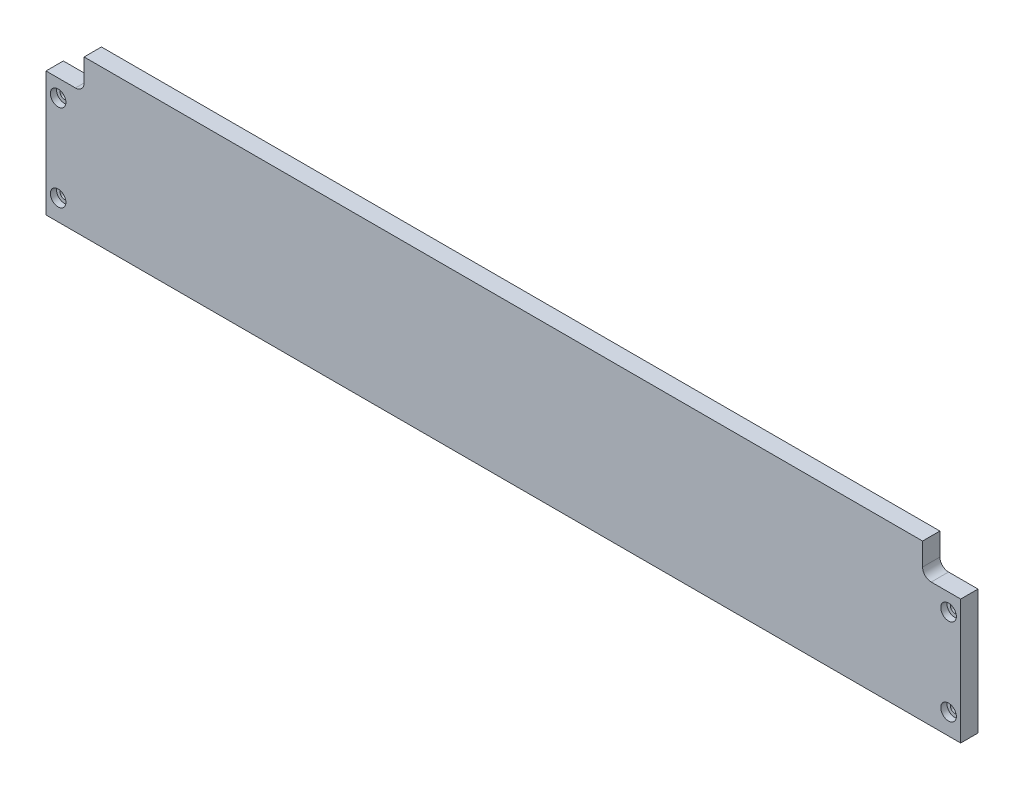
SolidWorks part; units mm, degrees
ref_plane "Front Plane" through (0, 0, 0) normal (0, 0, 1) x (1, 0, 0)
ref_plane "Top Plane" through (0, 0, 0) normal (0, 1, 0) x (1, 0, 0)
ref_plane "Right Plane" through (0, 0, 0) normal (1, 0, 0) x (0, 0, -1)
sketch "Sketch1" plane through (0, 0, 0) normal (0, 0, 1) x (1, 0, 0)
  line L0 (-1000, 0) -> (49000, 0) construction
  line L1 (0, -1000) -> (0, 49000) construction
  line L2 (335.28, 0) -> (-335.28, 0)
  line L3 (-335.28, 0) -> (-335.28, 91.44)
  line L4 (-335.28, 91.44) -> (-313.69, 91.44)
  line L5 (-307.34, 97.79) -> (-307.34, 114.3)
  line L6 (-307.34, 114.3) -> (307.34, 114.3)
  line L7 (307.34, 97.79) -> (307.34, 114.3)
  line L8 (335.28, 91.44) -> (313.69, 91.44)
  line L9 (335.28, 0) -> (335.28, 91.44)
  arc A0 (-313.69, 91.44) -> (-307.34, 97.79) centre (-313.69, 97.79) ccw
  arc A1 (313.69, 91.44) -> (307.34, 97.79) centre (313.69, 97.79) cw
  point P13 (-335.28, 45.72)
  point P18 (0, 114.3)
  point P20 (0, 0)
  dimension "D1" = 6.35
  dimension "D2" = 27.94
  dimension "D3" = 114.3
  dimension "D4" = 22.86
  dimension "D5" = 670.56
extrude "Boss-Extrude1" add sketch "Sketch1" along normal mid plane 12.7
sketch "Sketch2" plane through (0, 0, 6.35) normal (0, 0, 1) x (1, 0, 0)
  line L2 (335.28, 91.44) -> (313.69, 91.44) construction
  line L4 (335.28, 0) -> (335.28, 91.44) construction
  circle A0 centre (326.39, 78.74) radius 5.715
  dimension "D3" = 11.43
  dimension "D1" = 8.89
  dimension "D2" = 12.7
extrude "Cut-Extrude1" cut sketch "Sketch2" against normal blind 4.572
sketch "Sketch3" plane through (0, 0, 1.778) normal (0, 0, 1) x (1, 0, 0)
  circle A0 centre (326.39, 78.74) radius 3.175
  circle A1 centre (326.39, 78.74) radius 5.715 construction
  dimension "D1" = 6.35
extrude "Cut-Extrude2" cut sketch "Sketch3" against normal blind 11.43
pattern_linear "LPattern1" count 2 spacing 63.5 along (0, -1, 0) of "Cut-Extrude1", "Cut-Extrude2"
mirror "Mirror1" about plane through (0, 0, 0) normal (1, 0, 0) of "LPattern1", "Cut-Extrude1", "Cut-Extrude2"
